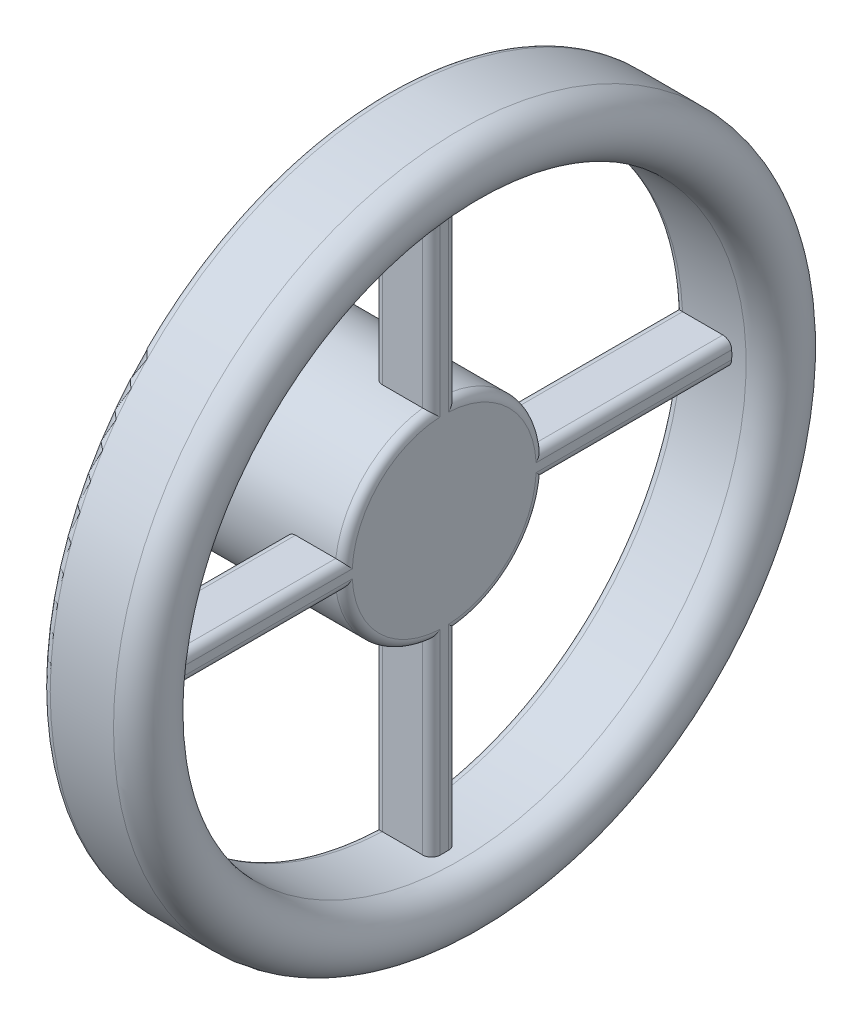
SolidWorks part; units mm, degrees
ref_plane "Front Plane" through (0, 0, 0) normal (0, 0, 1) x (1, 0, 0)
ref_plane "Top Plane" through (0, 0, 0) normal (0, 1, 0) x (1, 0, 0)
ref_plane "Right Plane" through (0, 0, 0) normal (1, 0, 0) x (0, 0, -1)
sketch "Sketch1" plane through (0, 0, 0) normal (0, 0, 1) x (1, 0, 0)
  line L0 (0, 0) -> (5, 0) construction
  line L1 (5, 0) -> (5, 12) construction
  line L2 (5, 12) -> (5, 10)
  line L3 (5, 10) -> (7.5, 10)
  line L4 (7.5, 12) -> (5, 12)
  arc A0 (7.5, 10) -> (7.5, 12) centre (7.5, 11) ccw
  dimension "D1" = 5
  dimension "D2" = 12
  dimension "D3" = 2
  dimension "D4" = 2.5
revolve "Revolve1" add sketch "Sketch1" angle 360 about L0
sketch "Sketch2" plane through (0, 0, 0) normal (1, 0, 0) x (0, 0, -1)
  circle A0 centre (0, 0) radius 3.5
  dimension "D1" = 7
extrude "Boss-Extrude1" add sketch "Sketch2" along normal blind 7 separate body
sketch "Sketch3" plane through (0, 0, 0) normal (-1, 0, 0) x (0, 0, 1)
  circle A0 centre (0, 0) radius 1.5
  dimension "D1" = 3
extrude "Cut-Extrude1" cut sketch "Sketch3" against normal blind 3
sketch "Sketch4" plane through (0, 0, 0) normal (0, 0, 1) x (1, 0, 0)
  line L0 (7, 3.5) -> (7, 10.5)
  line L3 (5, 10) -> (5, 3.5)
  line L4 (7, 3.5) -> (0, 3.5) construction
  line L5 (5, 12) -> (5, -12) construction
  line L7 (7, 10.5) -> (5, 10.5)
  line L8 (5, 10.5) -> (5, 10)
  line L9 (5, 2.4) -> (7, 2.4)
  line L10 (7, -3.5) -> (7, 3.5) construction
  line L11 (7, 2.4) -> (7, 3.5)
  line L12 (5, 3.5) -> (5, 2.4)
  dimension "D1" = 2.4
  dimension "D2" = 10.5
extrude "Boss-Extrude2" add sketch "Sketch4" along normal mid plane 0.9
fillet "Fillet1" radius 0.3 2 edges at (7, 6.7304, -0.45) (7, 6.7304, 0.45)
pattern_circular "CirPattern1" count 4 over 360 about axis through (0, 0, 0) along (1, 0, 0) of "Boss-Extrude2", "Fillet1"
fillet "Fillet2" radius 0.3 26 edges at (5, -7.0711, 7.0711) (5, 7.0711, -7.0711) (5, -6.7304, -0.45) (5, -6.7304, 0.45) (7, 2.4749, -2.4749) (5, -7.0711, -7.0711) (5, 0.45, -6.7304) (5, 6.7304, -0.45) (5, -0.45, -6.7304) (5, 6.7304, 0.45) (6.8864, 0.385, 3.4788) (6.9343, -0.3374, 3.4837) (6.8864, -3.4788, 0.385) (6.9343, -3.4837, -0.3374) (6.8864, -0.385, -3.4788) (6.9343, 0.3374, -3.4837) (0, 0, -3.5) (7, 2.4749, 2.4749) (5, 0, 12) (6.8864, 3.4788, -0.385) (6.9343, 3.4837, 0.3374) (7, -2.4749, 2.4749) (5, 7.0711, 7.0711) (5, -0.45, 6.7304) (5, 0.45, 6.7304) (7, -2.4749, -2.4749)
